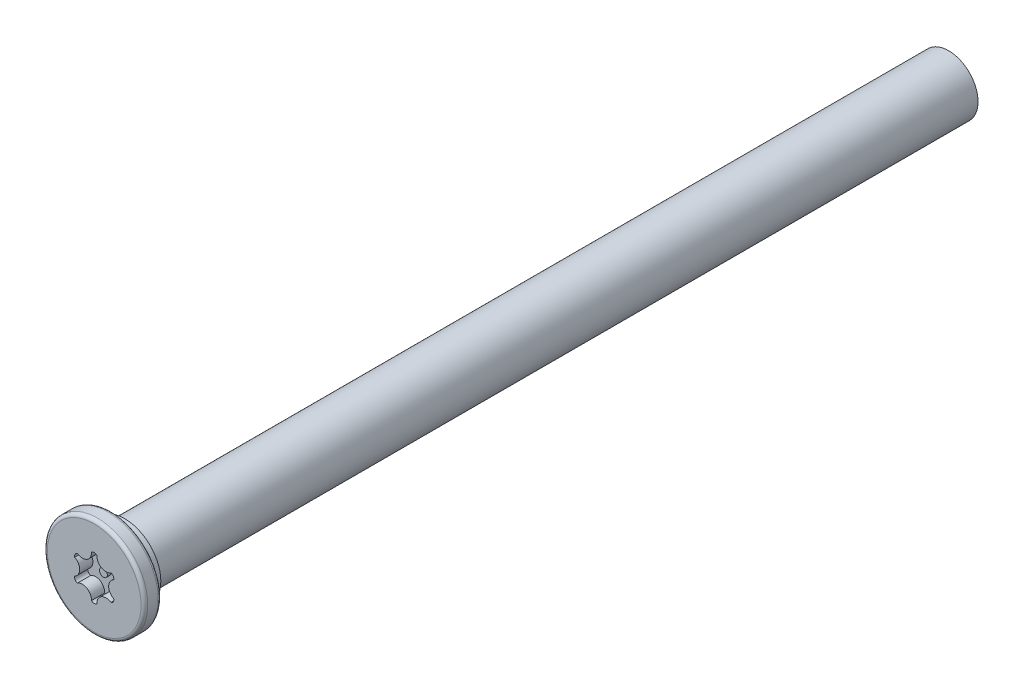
SolidWorks part; units mm, degrees
ref_plane "Front Plane" through (0, 0, 0) normal (0, 0, 1) x (1, 0, 0)
ref_plane "Top Plane" through (0, 0, 0) normal (0, 1, 0) x (1, 0, 0)
ref_plane "Right Plane" through (0, 0, 0) normal (1, 0, 0) x (0, 0, -1)
sketch "Sketch2" plane through (0, 0, 0) normal (1, 0, 0) x (0, 0, -1)
  line L1 (0, 0) -> (1.3, 0)
  line L2 (0, 0) -> (0, 3.81)
  line L3 (0, 3.81) -> (1.3, 3.81)
  line L4 (1.3, 0) -> (1.3, 3.81)
  line L5 (1.3, 0) -> (14, 0)
  line L6 (1.3, 0) -> (1.3, 2.23)
  line L7 (1.3, 2.23) -> (14, 2.23)
  line L8 (14, 0) -> (14, 2.23)
  dimension "D1" = 3.81
  dimension "D2" = 1.3
  dimension "D3" = 12.7
  dimension "D4" = 2.23
revolve "Revolve1" add sketch "Sketch2" angle 360 about L5
sketch "Sketch3" plane through (0, 0, 0) normal (0, 0, 1) x (1, 0, 0)
  line L0 (0, 1.3843) -> (0, 0)
  line L3 (1.1845, -1.0048) -> (2.4257, -1.0048)
  line L4 (0, 1.675) -> (0, 1.6727)
  line L5 (0, 1.675) -> (0, 1.6727)
  line L6 (0, 1.6727) -> (0, 1.675)
  line L8 (1.0407, 1.8026) -> (1.1012, 1.9073)
  line L9 (1.3857, 1.205) -> (2.5818, 1.205)
  line L10 (0, 0) -> (0.8375, 1.4506)
  line L11 (0, 0) -> (2.5818, 0)
  line L14 (2.5818, 0) -> (2.5818, 1.205)
  line L15 (1.3857, 1.205) -> (-0.1691, 1.205)
  circle A0 centre (0, 0) radius 1.675
  arc A7 (1.1845, -1.0048) -> (1.0345, -1.0748) centre (0.8546, -0.4934) cw
  arc A16 (-0.2051, 1.5894) -> (0.2051, 1.5894) centre (0, 1.3843) cw
  arc A18 (0.2051, 1.5894) -> (1.2739, 0.9723) centre (0.8938, 1.5482) ccw
  arc A19 (1.479, 0.6171) -> (1.479, -0.6171) centre (1.7877, 0) ccw
  arc A20 (1.2739, 0.9723) -> (1.479, 0.6171) centre (1.1988, 0.6922) cw
  arc A21 (1.2739, -0.9723) -> (0.2051, -1.5894) centre (0.8938, -1.5482) ccw
  arc A22 (1.479, -0.6171) -> (1.2739, -0.9723) centre (1.1988, -0.6922) cw
  arc A23 (-0.2051, -1.5894) -> (-1.2739, -0.9723) centre (-0.8938, -1.5482) ccw
  arc A24 (0.2051, -1.5894) -> (-0.2051, -1.5894) centre (0, -1.3843) cw
  arc A25 (-1.479, -0.6171) -> (-1.479, 0.6171) centre (-1.7877, 0) ccw
  arc A26 (-1.2739, -0.9723) -> (-1.479, -0.6171) centre (-1.1988, -0.6922) cw
  arc A27 (-1.2739, 0.9723) -> (-0.2051, 1.5894) centre (-0.8938, 1.5482) ccw
  arc A28 (-1.479, 0.6171) -> (-1.2739, 0.9723) centre (-1.1988, 0.6922) cw
  point P38 (0, 0)
  point P52 (0, 0)
  dimension "D1" = 3.35
  dimension "D4" = 1.205
  dimension "D2" = 6
  dimension "D5" = 60
extrude "Cut-Extrude3" cut sketch "Sketch3" against normal blind 1
fillet "Fillet12" radius 0.254 2 edges at (3.81, 0, 0) (3.81, 0, -1.3)
sketch "Sketch7" plane through (0, 0, -14) normal (0, 0, -1) x (-1, 0, 0)
  circle A0 centre (0, 0) radius 2.23
  dimension "D1" = 4.46
extrude "Cut-Extrude6" cut sketch "Sketch7" against normal blind 12.7
sketch "Sketch11" plane through (0, 0, -1.3) normal (0, 0, -1) x (-1, 0, 0)
  circle A0 centre (0, 0) radius 2.23
  circle A1 centre (0, 0) radius 2.738
extrude "Boss-Extrude1" add sketch "Sketch11" along normal blind 1.016
sketch "Sketch12" plane through (0, 0, -1.3) normal (0, 0, -1) x (-1, 0, 0)
  circle A0 centre (0, 0) radius 2.23
extrude "Boss-Extrude2" add sketch "Sketch12" along normal blind 12.7
sketch "Sketch14" plane through (0, 0, -1) normal (0, 0, 1) x (1, 0, 0)
  circle A0 centre (0, 0) radius 0.3
extrude "Boss-Extrude4" add sketch "Sketch14" along normal blind 0.3
sketch "Sketch15" plane through (0, 0, -14) normal (0, 0, -1) x (-1, 0, 0)
  circle A0 centre (0, 0) radius 2.23
extrude "Cut-Extrude7" cut sketch "Sketch15" against normal blind 12.7
sketch "Sketch16" plane through (0, 0, -1.3) normal (0, 0, -1) x (-1, 0, 0)
  circle A0 centre (0, 0) radius 2.23
extrude "Boss-Extrude5" add sketch "Sketch16" along normal blind 63.5
